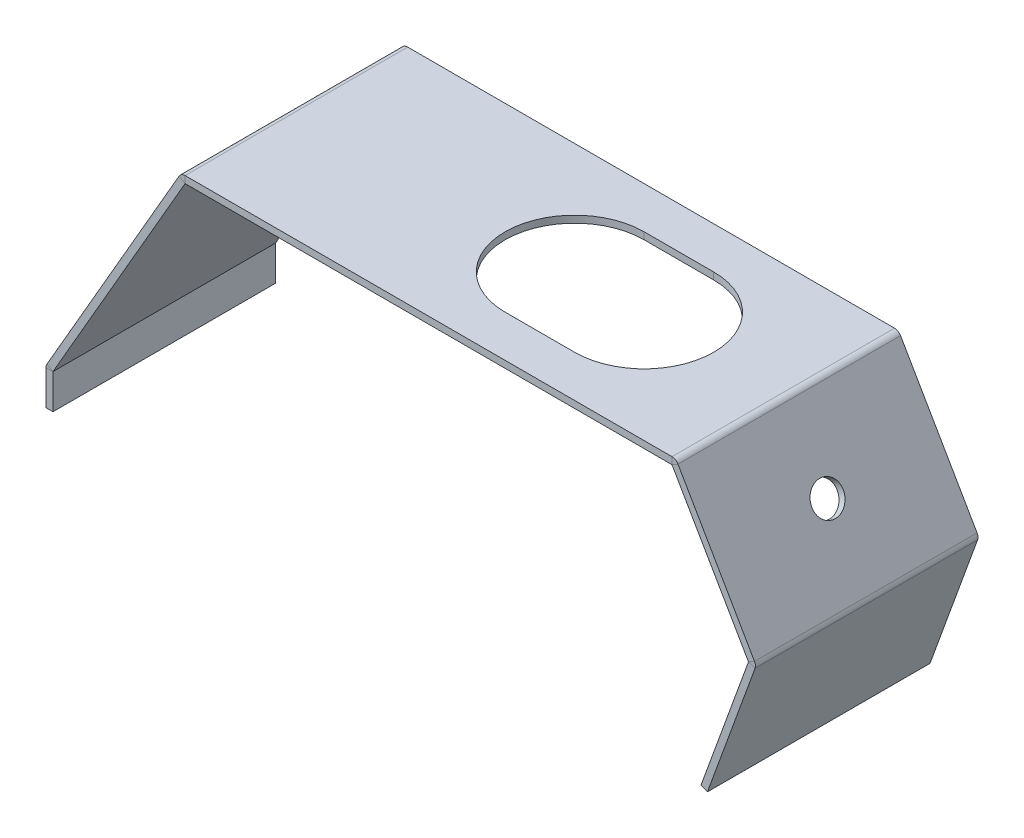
SolidWorks part; units mm, degrees
ref_plane "Front Plane" through (0, 0, 0) normal (0, 0, 1) x (1, 0, 0)
ref_plane "Top Plane" through (0, 0, 0) normal (0, 1, 0) x (1, 0, 0)
ref_plane "Right Plane" through (0, 0, 0) normal (1, 0, 0) x (0, 0, -1)
sketch "Sketch1" plane through (0, 0, 0) normal (0, 1, 0) x (1, 0, 0)
  line L0 (155, 16) -> (0, 16) construction
  line L1 (0, 0) -> (155, 0)
  line L2 (0, 0) -> (0, 32)
  line L3 (0, 32) -> (155, 32)
  line L4 (155, 0) -> (155, 32)
  line L5 (93, 26) -> (83, 26)
  line L6 (93, 6) -> (83, 6)
  circle A0 centre (124, 16) radius 2.25
  arc A2 (83, 26) -> (83, 6) centre (83, 16) ccw
  arc A4 (93, 6) -> (93, 26) centre (93, 16) ccw
  dimension "D3" = 31
  dimension "D4" = 4.5
  dimension "D5" = 10
  dimension "D6" = 10
  dimension "D7" = 62
  dimension "D1" = 32
  dimension "D2" = 155
sheet metal parameters "Sheet-Metal1" thickness 1 parameters "D1"=0.0001
base flange "Base-Flange1" sketch "Sketch1" thickness 1 reverse thickness direction yes parameters "D1"=0.0001
sketch "Sketch3" plane through (0, 1, 0) normal (0, 1, 0) x (1, 0, 0)
  line L0 (43, 32) -> (43, 0)
  line L1 (155, 32) -> (0, 32) construction
  line L2 (0, 0) -> (155, 0) construction
  line L3 (113, 32) -> (113, 0)
  line L4 (155, 0) -> (155, 32) construction
  line L5 (0, 32) -> (0, 0) construction
  dimension "D1" = 42
  dimension "D2" = 43
sketched bend "Sketched Bend1" parameters "D1"=0.001
bend "SketchBend1" bend radius 0.0001 bend angle 60 parameters "D5"=1
bend "SketchBend2" bend radius 0 bend angle 60 parameters "D5"=2
sketch "Sketch4" plane through (85.6161, 49.4305, 0) normal (0.866, 0.5, 0) x (0, 0, -1)
  line L0 (32, -78.5) -> (0, -78.5)
  line L1 (32, -98.5) -> (32, -56.5001) construction
  line L2 (0, -56.5001) -> (0, -98.5) construction
  line L3 (0, -98.5) -> (32, -98.5) construction
  dimension "D1" = 20
sketched bend "Sketched Bend3" parameters "D1"=0.001
bend "SketchBend4" bend radius 0.001 bend angle 50 parameters "D5"=3
sketch "Sketch5" plane through (31.3839, -18.1195, 0) normal (-0.866, 0.5, 0) x (0, 0, 1)
  line L0 (-32, -16.5) -> (0, -16.5)
  line L1 (-32, 21.4999) -> (-32, -21.5) construction
  line L2 (0, -21.5) -> (0, 21.4999) construction
  line L3 (-32, -21.5) -> (0, -21.5) construction
  dimension "D1" = 5
sketched bend "Sketched Bend5" parameters "D1"=0.001
bend "SketchBend6" bend radius 0.001 bend angle 30 parameters "D5"=4
flat pattern "Flat-Pattern1"
sketch "Bend-Lines1" plane through (0, 0, 0) normal (0, 1, 0) x (-1, 0, 0)
bend of the flat pattern "Flatten-<SketchBend1>1"
bend of the flat pattern "Flatten-<SketchBend2>1"
bend of the flat pattern "Flatten-<SketchBend4>1"
bend of the flat pattern "Flatten-<SketchBend6>1"
